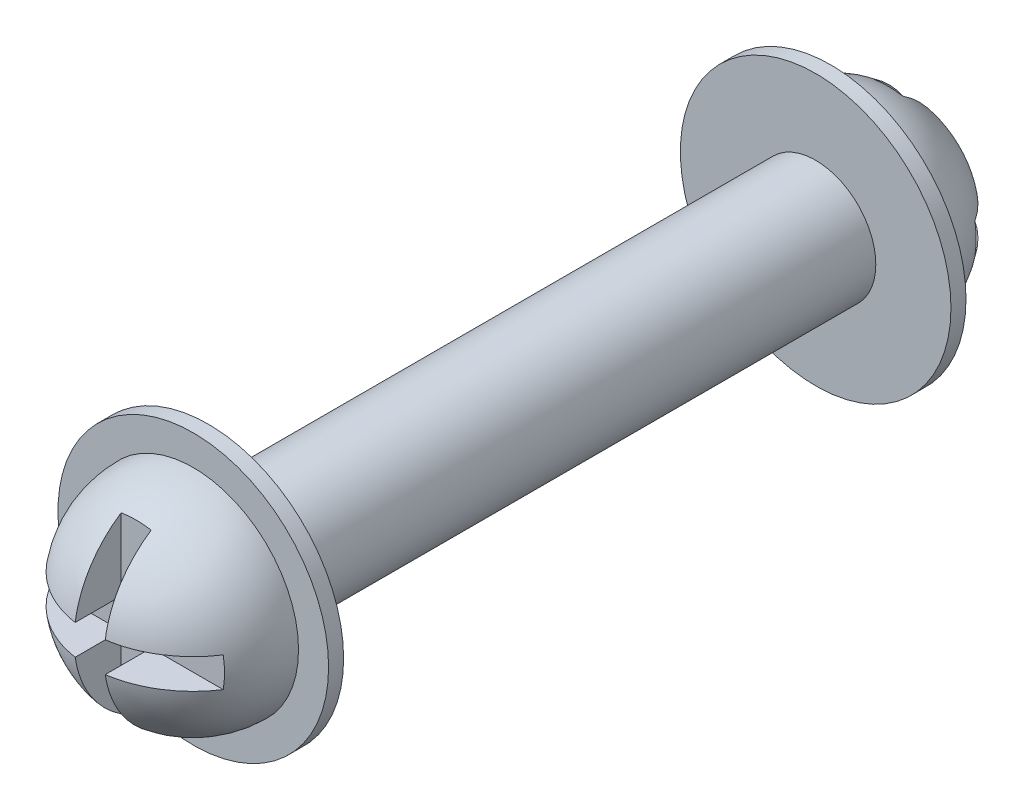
SolidWorks part; units mm, degrees
ref_plane "Front Plane" through (0, 0, 0) normal (0, 0, 1) x (1, 0, 0)
ref_plane "Top Plane" through (0, 0, 0) normal (0, 1, 0) x (1, 0, 0)
ref_plane "Right Plane" through (0, 0, 0) normal (1, 0, 0) x (0, 0, -1)
sketch "Sketch1" plane through (0, 0, 0) normal (1, 0, 0) x (0, 0, -1)
  line L0 (-32.0675, 6.35) -> (-32.0675, 14.2875)
  line L1 (-32.0675, 6.35) -> (32.0675, 6.35)
  line L2 (-77.1786, 0) -> (81.0028, 0) construction
  line L3 (33.655, 14.2875) -> (32.0675, 14.2875)
  line L4 (-44.7675, 0) -> (-44.7675, -11.2467) construction
  line L5 (0, 0) -> (0, 20.5642) construction
  line L7 (32.0675, 6.35) -> (32.0675, 14.2875)
  line L8 (-44.7675, 0) -> (44.7675, 0)
  line L9 (-33.655, 11.1125) -> (-33.655, 14.2875)
  line L10 (-33.655, 14.2875) -> (-32.0675, 14.2875)
  line L11 (33.655, 11.1125) -> (33.655, 14.2875)
  arc A0 (33.655, 11.1125) -> (44.7675, 0) centre (33.655, 0) cw
  arc A2 (-33.655, 11.1125) -> (-44.7675, 0) centre (-33.655, 0) ccw
  dimension "D2" = 64.135
  dimension "D4" = 89.535
  dimension "D1" = 12.7
  dimension "D3" = 28.575
  dimension "D5" = 1.5875
revolve "Revolve1" add sketch "Sketch1" angle 360 about L2
sketch "Sketch2" plane through (0, 0, 0) normal (1, 0, 0) x (0, 0, -1)
  line L0 (0, 0) -> (0, 18.0836) construction
  line L1 (-46.0375, 1.5875) -> (-39.6875, 1.5875)
  line L2 (-46.0375, 1.5875) -> (-46.0375, -1.5875)
  line L3 (-46.0375, -1.5875) -> (-39.6875, -1.5875)
  line L4 (-39.6875, 1.5875) -> (-39.6875, -1.5875)
  line L5 (0, 0) -> (-39.6875, 0) construction
  line L7 (39.6875, 1.5875) -> (39.6875, -1.5875)
  line L8 (46.0375, -1.5875) -> (39.6875, -1.5875)
  line L9 (46.0375, 1.5875) -> (46.0375, -1.5875)
  line L10 (46.0375, 1.5875) -> (39.6875, 1.5875)
  line L11 (-32.0675, -14.2875) -> (-32.0675, 14.2875) construction
  dimension "D1" = 3.175
  dimension "D2" = 6.35
  dimension "D3" = 7.62
extrude "Cut-Extrude1" cut sketch "Sketch2" against normal through all both and the other way through all
sketch "Sketch3" plane through (0.0527, 0, -0.0149) normal (0, 1, 0) x (0, 0, -1)
  line L0 (-0.0149, 0.0527) -> (-0.0149, 18.6125) construction
  line L1 (-47.3224, 1.6402) -> (-39.7024, 1.6402)
  line L2 (-47.3224, 1.6402) -> (-47.3224, -1.5348)
  line L3 (-47.3224, -1.5348) -> (-39.7024, -1.5348)
  line L4 (-39.7024, 1.6402) -> (-39.7024, -1.5348)
  line L5 (-0.0149, 0.0527) -> (-39.7024, 0.0527) construction
  line L7 (39.6726, 1.6402) -> (39.6726, -1.5348)
  line L8 (47.2926, -1.5348) -> (39.6726, -1.5348)
  line L9 (47.2926, 1.6402) -> (47.2926, -1.5348)
  line L10 (47.2926, 1.6402) -> (39.6726, 1.6402)
  line L11 (-39.7024, 9.2492) -> (-39.7024, -9.1439) construction
  dimension "D1" = 3.175
  dimension "D2" = 7.62
extrude "Cut-Extrude2" cut sketch "Sketch3" against normal through all both and the other way through all
